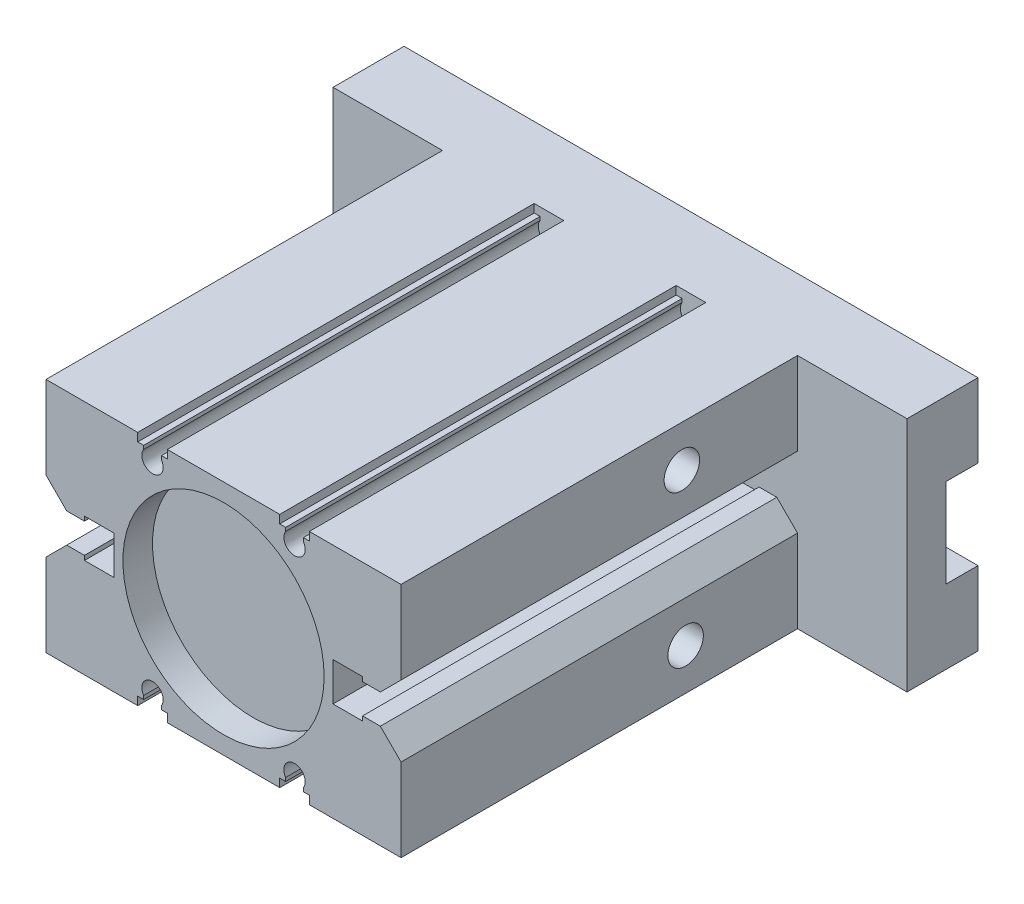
SolidWorks part; units mm, degrees
ref_plane "Front Plane" through (0, 0, 0) normal (0, 0, 1) x (1, 0, 0)
ref_plane "Top Plane" through (0, 0, 0) normal (0, 1, 0) x (1, 0, 0)
ref_plane "Right Plane" through (0, 0, 0) normal (1, 0, 0) x (0, 0, -1)
sketch "Sketch1" plane through (0, 0, 0) normal (0, 0, 1) x (1, 0, 0)
  line L1 (-30, 20) -> (30, 20)
  line L2 (-30, 20) -> (-30, -20)
  line L3 (-30, -20) -> (30, -20)
  line L4 (30, 20) -> (30, -20)
  line L5 (-30, 20) -> (30, -20) construction
  line L6 (-30, -20) -> (30, 20) construction
  point P0 (0, 0)
  dimension "D1" = 40
  dimension "D2" = 60
  dimension "D3" = 20
  dimension "D4" = 30
extrude "Boss-Extrude1" add sketch "Sketch1" along normal blind 67
sketch "Sketch3" plane through (0, 0, 67) normal (0, 0, 1) x (1, 0, 0)
  line L0 (18.5, -3.25) -> (18.5, 3.25)
  line L1 (18.5, 3.25) -> (23.5, 3.25)
  line L2 (23.5, 3.25) -> (23.5, 2.5)
  line L3 (26.5, -2.5) -> (30, -6)
  line L4 (23.5, 2.5) -> (26.5, 2.5)
  line L5 (26.5, 2.5) -> (30, 6)
  line L6 (30, -20) -> (30, 20) construction
  line L7 (0, 22.9112) -> (0, -20.8025) construction
  line L8 (23.5, -2.5) -> (26.5, -2.5)
  line L9 (23.5, -3.25) -> (23.5, -2.5)
  line L10 (18.5, -3.25) -> (23.5, -3.25)
  line L11 (30, 6) -> (30, -6)
  line L12 (-30, 6) -> (-30, -6)
  line L13 (-18.5, -3.25) -> (-23.5, -3.25)
  line L14 (-23.5, -3.25) -> (-23.5, -2.5)
  line L15 (-23.5, -2.5) -> (-26.5, -2.5)
  line L16 (-26.5, 2.5) -> (-30, 6)
  line L17 (-23.5, 2.5) -> (-26.5, 2.5)
  line L18 (-26.5, -2.5) -> (-30, -6)
  line L19 (-23.5, 3.25) -> (-23.5, 2.5)
  line L20 (-18.5, 3.25) -> (-23.5, 3.25)
  line L21 (-18.5, -3.25) -> (-18.5, 3.25)
  line L22 (9.5, -20) -> (9.5, -18.6)
  line L23 (-30, -20) -> (30, -20) construction
  line L24 (9.5, -18.6) -> (10.5, -18.6)
  line L25 (10.5, -18.6) -> (10.5, -18)
  line L27 (13.5, -18) -> (13.5, -18.6)
  line L28 (13.5, -18.6) -> (14.5, -18.6)
  line L29 (14.5, -18.6) -> (14.5, -20)
  line L30 (14.5, -20) -> (9.5, -20)
  line L31 (-14.5, -20) -> (-9.5, -20)
  line L32 (-14.5, -18.6) -> (-14.5, -20)
  line L33 (-13.5, -18.6) -> (-14.5, -18.6)
  line L34 (-13.5, -18) -> (-13.5, -18.6)
  line L35 (-10.5, -18.6) -> (-10.5, -18)
  line L36 (-9.5, -18.6) -> (-10.5, -18.6)
  line L37 (-9.5, -20) -> (-9.5, -18.6)
  line L38 (-35.0465, 0) -> (45.9504, 0) construction
  line L39 (-9.5, 20) -> (-9.5, 18.6)
  line L40 (-9.5, 18.6) -> (-10.5, 18.6)
  line L41 (-10.5, 18.6) -> (-10.5, 18)
  line L42 (-13.5, 18) -> (-13.5, 18.6)
  line L43 (-13.5, 18.6) -> (-14.5, 18.6)
  line L44 (-14.5, 18.6) -> (-14.5, 20)
  line L45 (-14.5, 20) -> (-9.5, 20)
  line L46 (14.5, 20) -> (9.5, 20)
  line L47 (14.5, 18.6) -> (14.5, 20)
  line L48 (13.5, 18.6) -> (14.5, 18.6)
  line L49 (13.5, 18) -> (13.5, 18.6)
  line L50 (10.5, 18.6) -> (10.5, 18)
  line L51 (9.5, 18.6) -> (10.5, 18.6)
  line L52 (9.5, 20) -> (9.5, 18.6)
  arc A0 (13.5, -18) -> (10.5, -18) centre (12, -17) ccw
  arc A1 (-13.5, -18) -> (-10.5, -18) centre (-12, -17) cw
  arc A2 (-13.5, 18) -> (-10.5, 18) centre (-12, 17) ccw
  arc A3 (13.5, 18) -> (10.5, 18) centre (12, 17) cw
  point P11 (18.5, 0)
  point P27 (-18.5, 0)
  point P37 (12, -17)
  point P48 (-12, -17)
  point P69 (-12, 17)
  point P70 (12, 17)
  dimension "D1" = 11.5
  dimension "D2" = 5
  dimension "D3" = 3
  dimension "D4" = 5
  dimension "D5" = 3
  dimension "D6" = 15.5
  dimension "D7" = 1.5
  dimension "D9" = 1.4
  dimension "D10" = 1.4
  dimension "D11" = 0.6
  dimension "D12" = 0.6
extrude "Cut-Extrude1" cut sketch "Sketch3" against normal through all
sketch "Sketch4" plane through (0, 0, 67) normal (0, 0, 1) x (1, 0, 0)
  circle A0 centre (0, 0) radius 17
  dimension "D1" = 34
extrude "Cut-Extrude2" cut sketch "Sketch4" against normal blind 5
sketch "Sketch5" plane through (0, 0, 0) normal (0, 0, -1) x (-1, 0, 0)
  line L1 (-48.5, 20) -> (48.5, 20)
  line L2 (-48.5, 20) -> (-48.5, -20)
  line L3 (-48.5, -20) -> (48.5, -20)
  line L4 (48.5, 20) -> (48.5, -20)
  line L5 (-48.5, 20) -> (48.5, -20) construction
  line L6 (-48.5, -20) -> (48.5, 20) construction
  point P0 (0, 0)
  dimension "D1" = 40
  dimension "D2" = 97
extrude "Boss-Extrude2" add sketch "Sketch5" along normal blind 12
sketch "Sketch7" plane through (-48.5, 0, 0) normal (-1, 0, 0) x (0, 0, 1)
  line L0 (-12, 7.5) -> (-6.6325, 7.5)
  line L1 (-12, -20) -> (-12, 20) construction
  line L2 (-6.6325, 7.5) -> (-6.6325, -7.5)
  line L3 (-6.6325, -7.5) -> (-12, -7.5)
  line L4 (-12, -7.5) -> (-12, 7.5)
  dimension "D1" = 15
  dimension "D2" = 7.5
extrude "Cut-Extrude3" cut sketch "Sketch7" against normal through all
sketch "Sketch8" plane through (30, 0, 0) normal (1, 0, 0) x (0, 0, -1)
  circle A0 centre (-18.9096, -13) radius 3
  circle A1 centre (-19.5465, 13) radius 3
  dimension "D1" = 6
  dimension "D2" = 6
  dimension "D3" = 26
  dimension "D4" = 13
extrude "Cut-Extrude4" cut sketch "Sketch8" against normal blind 12
sketch "Sketch9" plane through (-30, 0, 0) normal (-1, 0, 0) x (0, 0, 1)
  circle A0 centre (36.7641, -12.943) radius 3
  circle A1 centre (56.7641, 13.901) radius 3
  dimension "D1" = 6
  dimension "D2" = 6
  dimension "D3" = 20
extrude "Cut-Extrude5" cut sketch "Sketch9" against normal blind 12
